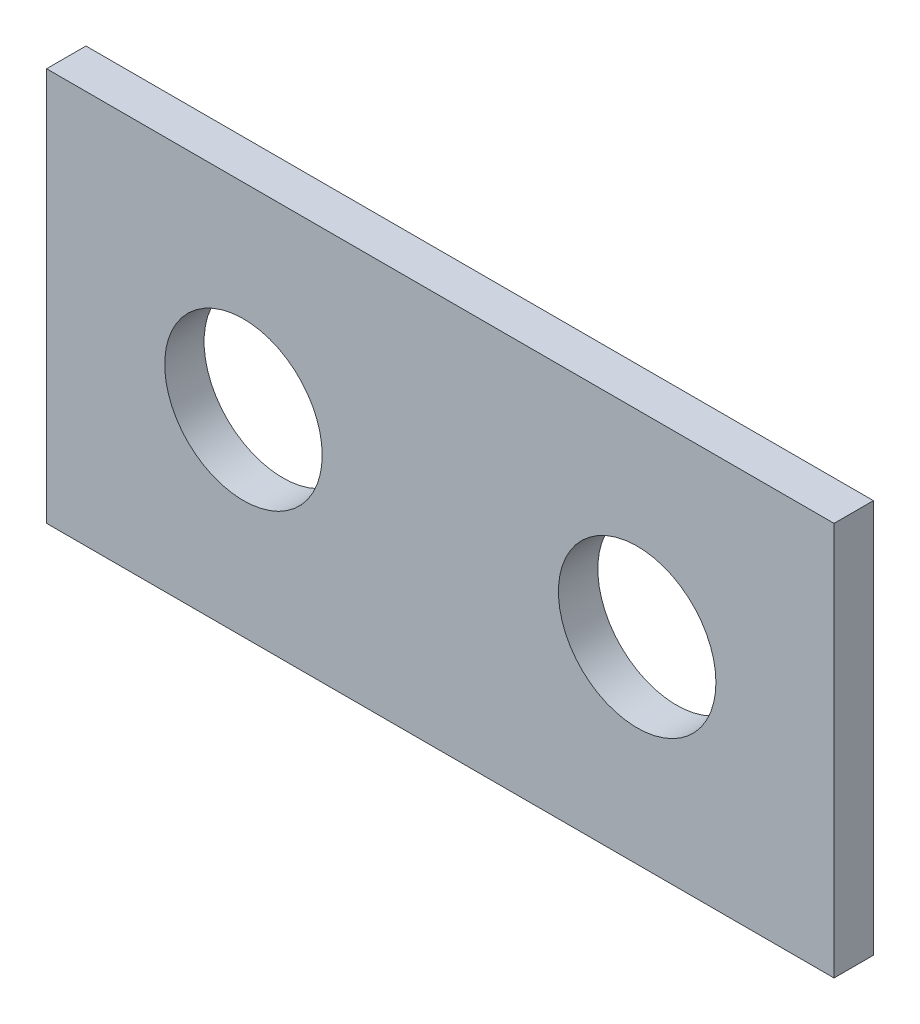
SolidWorks part; units mm, degrees
ref_plane "Front" through (0, 0, 0) normal (0, 0, 1) x (1, 0, 0)
ref_plane "Top" through (0, 0, 0) normal (0, 1, 0) x (1, 0, 0)
ref_plane "Right" through (0, 0, 0) normal (1, 0, 0) x (0, 0, -1)
sketch "Sketch1" plane through (0, 0, 0) normal (0, 0, 1) x (1, 0, 0)
  line L0 (0, 0) -> (116.9777, 0) construction
  line L1 (0, 0) -> (0, 81.8423) construction
  line L3 (-50, -25) -> (50, -25)
  line L4 (-50, -25) -> (-50, 25)
  line L5 (-50, 25) -> (50, 25)
  line L6 (50, -25) -> (50, 25)
  dimension "D1" = 100
  dimension "D2" = 50
  dimension "D3" = 50
  dimension "D4" = 25
extrude "Extrude1" add sketch "Sketch1" along normal blind 5
sketch "hole 1 sketch" plane through (0, 0, 5) normal (0, 0, 1) x (1, 0, 0)
  line L0 (0, 0) -> (55.0535, 0) construction
  line L1 (0, 0) -> (0, 41.7503) construction
  line L2 (50, -25) -> (50, 25) construction
  circle A0 centre (25, 0) radius 10
  dimension "D1" = 20
  dimension "D2" = 25
extrude "hole 1" cut sketch "hole 1 sketch" against normal through all
sketch "hole 2 sketch" plane through (0, 0, 5) normal (0, 0, 1) x (1, 0, 0)
  line L0 (0, 0) -> (-44.0094, 0) construction
  line L1 (-50, 25) -> (-50, -25) construction
  circle A0 centre (-25, 0) radius 10
  dimension "D1" = 20
  dimension "D2" = 25
extrude "hole 2" cut sketch "hole 2 sketch" against normal through all
equation "\"D1@hole 2 sketch\" = \"D1@hole 1 sketch\""
